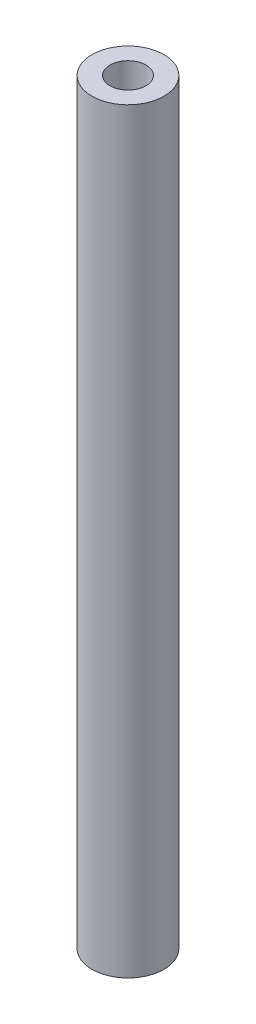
SolidWorks part; units mm, degrees
ref_plane "Front Plane" through (0, 0, 0) normal (0, 0, 1) x (1, 0, 0)
ref_plane "Top Plane" through (0, 0, 0) normal (0, 1, 0) x (1, 0, 0)
ref_plane "Right Plane" through (0, 0, 0) normal (1, 0, 0) x (0, 0, -1)
sketch "Sketch1" plane through (0, 0, 0) normal (0, 1, 0) x (1, 0, 0)
  circle A0 centre (0, 0) radius 1.27
  circle A1 centre (0, 0) radius 2.54
  dimension "D1" = 2.54
  dimension "D2" = 5.08
extrude "Boss-Extrude1" add sketch "Sketch1" along normal blind 53.34
